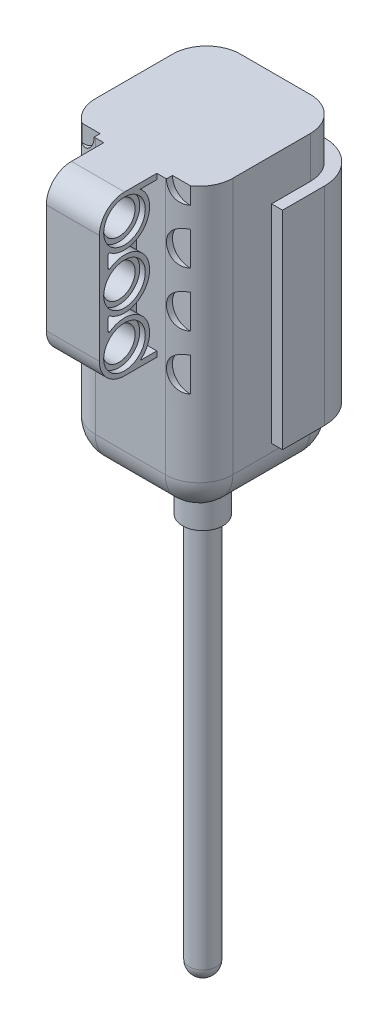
SolidWorks part; units mm, degrees
ref_plane "Front Plane" through (0, 0, 0) normal (0, 0, 1) x (1, 0, 0)
ref_plane "Top Plane" through (0, 0, 0) normal (0, 1, 0) x (1, 0, 0)
ref_plane "Right Plane" through (0, 0, 0) normal (1, 0, 0) x (0, 0, -1)
imported_body "Imported1"
sketch "Esquisse3" plane through (0, -11.5, 0) normal (0, -1, 0) x (1, 0, 0)
  circle A0 centre (0, 0) radius 9
  dimension "D1" = 18
extrude "Boss.-Extru.4" add sketch "Esquisse3" along normal blind 8
sketch "Esquisse5" plane through (0, -21.5, 0) normal (0, -1, 0) x (1, 0, 0)
  circle A0 centre (0, 0) radius 2
  dimension "D1" = 4
extrude "Boss.-Extru.5" add sketch "Esquisse5" along normal blind 65
sketch "Esquisse6" plane through (0, -86.5, 0) normal (0, -1, 0) x (1, 0, 0)
  line L0 (0, 2) -> (0, -2)
  circle A0 centre (0, 0) radius 2 construction
  arc A1 (0, 2) -> (0, -2) centre (0, 0) cw
revolve "Révolution1" add sketch "Esquisse6" angle 180 about L0
sketch "Esquisse7" plane through (0, -21.5, 0) normal (0, -1, 0) x (1, 0, 0)
  circle A0 centre (0, 0) radius 3
  dimension "D1" = 6
extrude "Boss.-Extru.6" add sketch "Esquisse7" along normal blind 8
sketch "Esquisse9" plane through (0, -19.5, 0) normal (0, -1, 0) x (1, 0, 0)
  line L0 (1, 5.51) -> (1, 7.67)
  line L1 (-1, 7.67) -> (-1, 5.51)
  line L2 (-1, 5.51) -> (1, 5.51)
  arc A0 (1, 7.67) -> (-1, 7.67) centre (0, 7.67) ccw
extrude "Boss.-Extru.8" add sketch "Esquisse9" along normal up to surface (1.6083 mm away)
sketch "Esquisse10" plane through (0, -19.5, 0) normal (0, -1, 0) x (1, 0, 0)
  line L0 (-5.51, 1) -> (-7.18, 1)
  line L1 (-7.18, -1) -> (-5.51, -1)
  line L2 (-5.51, -1) -> (-5.51, 1)
  arc A0 (-7.18, 1) -> (-7.18, -1) centre (-7.18, 0) ccw
extrude "Boss.-Extru.9" add sketch "Esquisse10" along normal up to surface (1.5826 mm away)
sketch "Esquisse11" plane through (0, -19.5, 0) normal (0, -1, 0) x (1, 0, 0)
  line L0 (5.51, 1) -> (7.18, 1)
  line L1 (7.18, -1) -> (5.51, -1)
  line L2 (5.51, -1) -> (5.51, 1)
  arc A0 (7.18, 1) -> (7.18, -1) centre (7.18, 0) cw
extrude "Boss.-Extru.10" add sketch "Esquisse11" along normal up to surface (1.9891 mm away)
sketch "Esquisse12" plane through (0, -19.5, 0) normal (0, -1, 0) x (1, 0, 0)
  line L0 (1, -5.51) -> (1, -7.67)
  line L1 (-1, -7.67) -> (-1, -5.51)
  line L2 (-1, -5.51) -> (1, -5.51)
  arc A0 (1, -7.67) -> (-1, -7.67) centre (0, -7.67) cw
  arc A1 (-1, -7.67) -> (1, -7.67) centre (0, -7.67) ccw construction
  arc A2 (-1, -7.67) -> (1, -7.67) centre (0, -7.67) ccw construction
extrude "Boss.-Extru.12" add sketch "Esquisse12" along normal up to surface (1.9952 mm away)
sketch "Esquisse16" plane through (0, -19.5, 0) normal (0, -1, 0) x (1, 0, 0)
  line L0 (-1, 5.51) -> (1, 5.51)
  line L1 (5.51, 1) -> (5.51, -1)
  line L2 (-5.51, 1) -> (-5.51, -1)
  line L3 (-1, -5.51) -> (1, -5.51)
  arc A0 (-5.51, 1) -> (-1, 5.51) centre (0, 0) cw
  arc A1 (1, 5.51) -> (5.51, 1) centre (0, 0) cw
  arc A2 (5.51, -1) -> (1, -5.51) centre (0, 0) cw
  arc A3 (-1, -5.51) -> (-5.51, -1) centre (0, 0) cw
extrude "Boss.-Extru.14" add sketch "Esquisse16" along normal up to surface (2 mm away)
sketch "Esquisse17" plane through (0, 9, 0) normal (0, 1, 0) x (-1, 0, 0)
  line L0 (6.25, -6.15) -> (-6.25, -6.15)
  line L1 (-6.25, -6.15) -> (-6.25, 8.35)
  line L2 (6.25, -6.15) -> (6.25, 8.35)
  line L3 (5.75, 8.85) -> (-5.75, 8.85)
  arc A0 (-5.75, 8.85) -> (-6.25, 8.35) centre (-5.75, 8.35) ccw
  arc A1 (5.75, 8.85) -> (6.25, 8.35) centre (5.75, 8.35) cw
extrude "Boss.-Extru.15" add sketch "Esquisse17" along normal up to surface (12.5 mm away)
